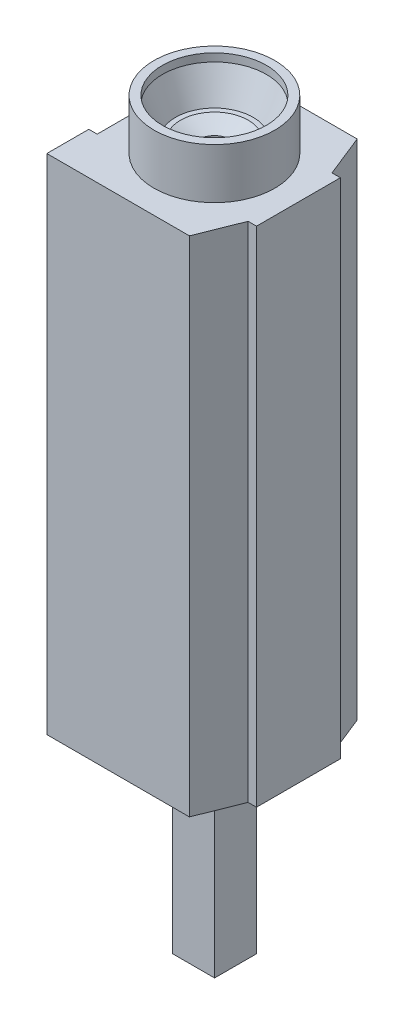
SolidWorks part; units mm, degrees
ref_plane "Front Plane" through (0, 0, 0) normal (0, 0, 1) x (1, 0, 0)
ref_plane "Top Plane" through (0, 0, 0) normal (0, 1, 0) x (1, 0, 0)
ref_plane "Right Plane" through (0, 0, 0) normal (1, 0, 0) x (0, 0, -1)
ref_plane "Pos 1 Plane" through (-0.0025, 0, 0) normal (1, 0, 0) x (0, 0, -1)
ref_plane "L Plane 1" through (0, 0, 0) normal (1, 0, 0) x (0, 0, -1)
ref_plane "L Plane 2" through (-2.54, 0, 0) normal (1, 0, 0) x (0, 0, -1)
sketch "Sketch1" plane through (0, 0, 0) normal (0, 1, 0) x (1, 0, 0)
  line L0 (-1.27, 1.27) -> (1.27, -1.27) construction
  line L3 (-1.27, 1.27) -> (1.27, 1.27)
  line L5 (1.27, 1.27) -> (1.27, -1.27) construction
  line L6 (-1.27, -1.27) -> (1.27, -1.27)
  line L7 (1.27, 1.27) -> (1.27, -1.27)
  line L8 (-1.27, 1.27) -> (-1.27, 0.635)
  line L11 (-1.27, -0.635) -> (-1.27, -1.27)
  line L12 (-1.27, 0.635) -> (-1.143, 0.635)
  line L14 (-1.27, -0.635) -> (-1.143, -0.635)
  line L16 (-1.143, 0.635) -> (-1.143, -0.635)
  point P1 (0, 0)
  dimension "D1" = 2.54
  dimension "D2" = 2.54
  dimension "D3" = 0.635
  dimension "D4" = 0.635
  dimension "D8" = 0.127
extrude "Body 1" add sketch "Sketch1" along normal blind 7.62
sketch "Sketch5" plane through (0, 7.62, 0) normal (0, 1, 0) x (1, 0, 0)
  line L0 (0.889, 1.27) -> (1.651, 1.27)
  line L1 (1.143, -0.635) -> (0.889, -1.27)
  line L2 (1.27, -0.05) -> (1.27, 1.27) construction
  line L4 (-1.27, 1.27) -> (-1.27, 0.635) construction
  line L5 (1.27, 1.27) -> (-1.27, 1.27) construction
  line L6 (1.397, 0.635) -> (1.651, 1.27)
  line L7 (0, 0) -> (-0.5543, 0) construction
  line L8 (1.397, -0.635) -> (1.143, -0.635)
  line L9 (1.397, -0.635) -> (1.651, -1.27)
  line L10 (0.889, -1.27) -> (1.651, -1.27)
  line L275 (1.397, 0.635) -> (1.143, 0.635)
  line L276 (1.143, 0.635) -> (0.889, 1.27)
  dimension "D1" = 0.381
  dimension "D2" = 0.635
  dimension "D3" = 0.127
  dimension "D4" = 2.54
extrude "Cut 1" cut sketch "Sketch5" against normal up to surface (7.62 mm away)
sketch "Sketch3" plane through (-0.0025, 0, 0) normal (1, 0, 0) x (0, 0, -1)
  line L0 (0, 0.3378) -> (0, 0.2836) construction
  line L1 (-0.7874, 8.382) -> (-0.9144, 8.382)
  line L2 (-0.5873, 7.7999) -> (-0.5123, 7.7999)
  line L3 (-0.2399, 7.62) -> (-0.9134, 7.62)
  line L4 (-0.9144, 8.382) -> (-0.9144, 7.6195)
  line L6 (-0.7874, 8.382) -> (-0.7874, 8.2625)
  line L7 (-0.7874, 8.2625) -> (-0.5873, 7.7999)
  line L8 (-0.5123, 7.7999) -> (-0.2399, 7.6842)
  line L9 (-1.27, 7.62) -> (-1.27, 0) construction
  line L11 (-0.635, 7.62) -> (-1.27, 7.62) construction
  line L14 (-0.2399, 7.6842) -> (-0.2399, 7.62)
  line L15 (-0.9134, 7.62) -> (-0.9134, 7.6195)
  line L16 (-0.9134, 7.6195) -> (-0.9144, 7.6195)
  dimension "D1" = 1.27
  dimension "D2" = 0.9144
  dimension "D3" = 0.127
  dimension "D4" = 0.762
  dimension "D5" = 0.5821
  dimension "D6" = 0.6745
  dimension "D7" = 0.2724
  dimension "D8" = 0.2001
  dimension "D9" = 0.0642
  dimension "D10" = 0.5039
  dimension "D11" = 0.0005
  dimension "D12" = 0.001
revolve "Contact Top" add sketch "Sketch3" angle 360 about L0
sketch "Sketch6" plane through (0, 0, 0) normal (0, -1, 0) x (1, 0, 0)
  line L0 (-0.3175, 0.3175) -> (0.3175, -0.3175) construction
  line L1 (-0.3175, 0.3175) -> (0.3175, 0.3175)
  line L2 (-0.3175, 0.3175) -> (-0.3175, -0.3175)
  line L3 (-0.3175, -0.3175) -> (0.3175, -0.3175)
  line L4 (0.3175, 0.3175) -> (0.3175, -0.3175)
  line L5 (0.889, -1.27) -> (-1.27, -1.27) construction
  line L8 (-1.27, -1.27) -> (-1.27, -0.635) construction
  point P8 (0, 0)
  point P10 (-1.27, -0.9525)
  dimension "D1" = 0.635
  dimension "D2" = 1.27
  dimension "D3" = 1.27
extrude "Contact Tail" add sketch "Sketch6" along normal blind 3.1242
chamfer "Contact Tail Point" distance 0.25 angle 45 4 edges at (0, -3.1242, 0.3175) (0.3175, -3.1242, 0) (0, -3.1242, -0.3175) (-0.3175, -3.1242, 0)
sketch "Sketch7" plane through (0, 0, 0) normal (1, 0, 0) x (0, 0, -1)
  line L0 (-2.1228, -1.016) -> (2.0493, -1.016) construction
  line L1 (-0.635, 0) -> (0.635, 0) construction
  line L2 (0, 0) -> (0, -3.5799) construction
  line L3 (0.5207, -1.016) -> (0.3175, -0.8128)
  line L4 (0.3175, -0.8128) -> (0.3175, -1.2192)
  line L5 (0.3175, -1.2192) -> (0.5207, -1.016)
  dimension "D1" = 1.016
  dimension "D2" = 0.3175
  dimension "D3" = 0.2032
sketch "Sketch8" plane through (-2.54, 0, 0) normal (1, 0, 0) x (0, 0, -1)
  line L0 (0, 0) -> (0, -2.2512) construction
  line L1 (0, 0) -> (0, -3.5799) construction
  line L2 (-0.3175, -1.2192) -> (-0.5207, -1.016)
  line L3 (-0.3175, -0.8128) -> (-0.3175, -1.2192)
  line L4 (-0.5207, -1.016) -> (-0.3175, -0.8128)
  line L5 (-0.635, 0) -> (0.635, 0) construction
  dimension "D1" = 0.3175
  dimension "D2" = 0.2032
  dimension "D3" = 1.016
sketch "Sketch10" plane through (-2.54, 0, 0) normal (1, 0, 0) x (0, 0, -1)
  line L0 (0.3175, -2.8742) -> (0.3175, 0) construction
  line L4 (-0.635, 0) -> (0.635, 0) construction
  line L6 (0.1143, -1.016) -> (0.3175, -1.2192)
  line L7 (0.3175, -0.8128) -> (0.1143, -1.016)
  line L8 (0.3175, -1.2192) -> (0.3175, -0.8128)
  dimension "D1" = 0.2032
  dimension "D2" = 1.016
